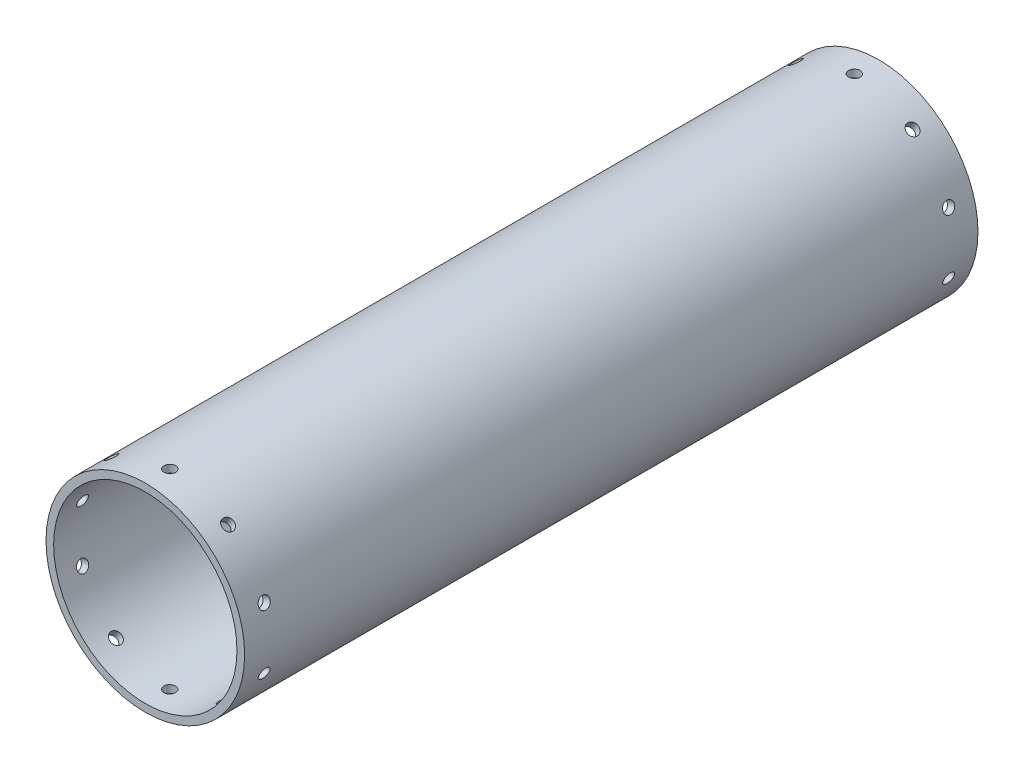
SolidWorks part; units mm, degrees
ref_plane "Front Plane" through (0, 0, 0) normal (0, 0, 1) x (1, 0, 0)
ref_plane "Top Plane" through (0, 0, 0) normal (0, 1, 0) x (1, 0, 0)
ref_plane "Right Plane" through (0, 0, 0) normal (1, 0, 0) x (0, 0, -1)
sketch "Sketch1" plane through (0, 0, 0) normal (0, 0, 1) x (1, 0, 0)
  circle A0 centre (0, 0) radius 41.275
  circle A1 centre (0, 0) radius 38.1
  dimension "D1" = 76.2
  dimension "D2" = 82.55
extrude "Boss-Extrude2" add sketch "Sketch1" along normal blind 304.8 contours A0 | A1
ref_plane "Plane1" through (0, 41.275, 0) normal (0, 1, 0) x (1, 0, 0)
sketch "Sketch4" plane through (0, 41.275, 0) normal (0, 1, 0) x (1, 0, 0)
  line L0 (38.1, 0) -> (-38.1, 0) construction
  circle A0 centre (0, -10.16) radius 2.413
extrude "Cut-Extrude1" cut sketch "Sketch4" against normal up to next
pattern_circular "CirPattern1" count 10 over 360 about axis through (0, 0, 304.8) along (0, 0, -1) of "Cut-Extrude1"
sketch "Sketch5" plane through (0, 41.275, 0) normal (0, 1, 0) x (1, 0, 0)
  line L0 (-41.275, -304.8) -> (41.275, -304.8) construction
  line L1 (-41.275, -304.8) -> (41.275, -304.8) construction
  circle A0 centre (0, -294.64) radius 2.413
  point P4 (0, -304.8)
extrude "Cut-Extrude2" cut sketch "Sketch5" against normal up to next
pattern_circular "CirPattern2" count 10 over 360 about axis through (0, 0, 304.8) along (0, 0, -1) of "Cut-Extrude2"
equation "\"FGL\"= 5in'Fuel Grain Length"
equation "\"B\"= 0.89244in'Bulkhead"
equation "\"ID\"= 2.225in'Inner Diameter"
equation "\"D1@Boss-Extrude2\"= 12"
equation "\"TS\" = 0.4in'Tear-Out Stress Distance"
equation "\"D2@Sketch4\"=\"TS\""
equation "\"D2@Sketch5\"=\"TS\""
equation "\"EL\"= 0.74819in'Entrance Length"
equation "\"Bottom Bolt Distance\"= ( 12 - ( \"FGL\" + 1.5 * \"ID\" + 4 * \"TS\" + \"EL\" + \"B\" ) )"
